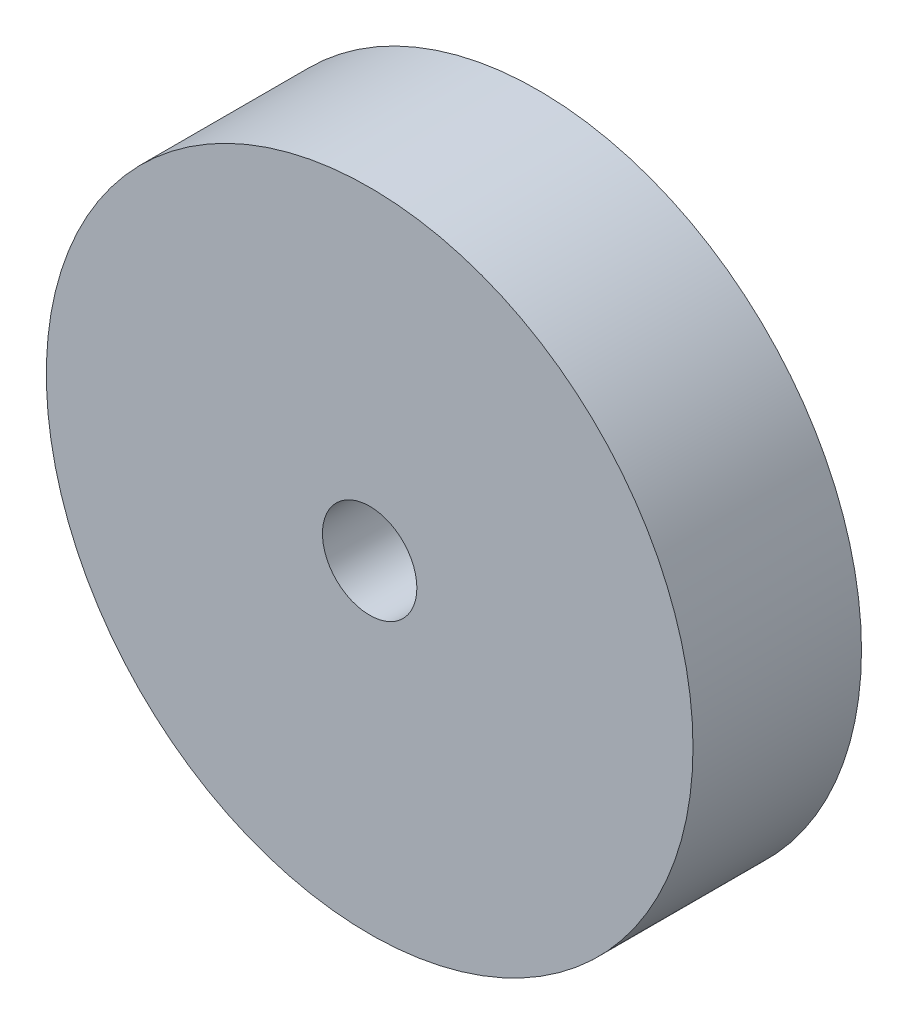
SolidWorks part; units mm, degrees
ref_plane "Front" through (0, 0, 0) normal (0, 0, 1) x (1, 0, 0)
ref_plane "Top" through (0, 0, 0) normal (0, 1, 0) x (1, 0, 0)
ref_plane "Right" through (0, 0, 0) normal (1, 0, 0) x (0, 0, -1)
sketch "Sketch1" plane through (0, 0, 0) normal (1, 0, 0) x (0, 0, -1)
  line L0 (0, 0) -> (6, 0) construction
  line L1 (-9.1, 34.925) -> (9.1, 34.925)
  line L2 (-9.1, 34.925) -> (-9.1, 0)
  line L3 (-9.1, 0) -> (9.1, 0)
  line L4 (9.1, 34.925) -> (9.1, 0)
  line L5 (0, 5.1594) -> (0, 0) construction
  dimension "D1" = 69.85
  dimension "D2" = 18.2
revolve "Base-Revolve" add sketch "Sketch1" angle 360 about L0
hole_wizard "M12x1.75 Tapped Hole1" positions "Sketch3" profile "Sketch2" tap size "M12x1.75" standard "Ansi Metric"
sketch "Sketch3" plane through (0, 0, 9.1) normal (0, 0, 1) x (1, 0, 0)
  point P0 (0, 0)
sketch "Sketch2" plane through (0, 0, 9.1) normal (1, 0, 0) x (0, -1, 0)
  line L0 (0, 0) -> (0, 18.2)
  line L1 (0, 18.2) -> (5.1, 18.2)
  line L2 (5.1, 18.2) -> (5.1, 0)
  line L5 (5.1, 0) -> (0, 0)
  line L11 (0, -6.35) -> (0, 107.95) construction
  dimension "Thru Tap Drill Dia." = 10.2
  dimension "Thru Tap Drill Depth" = 18.2
